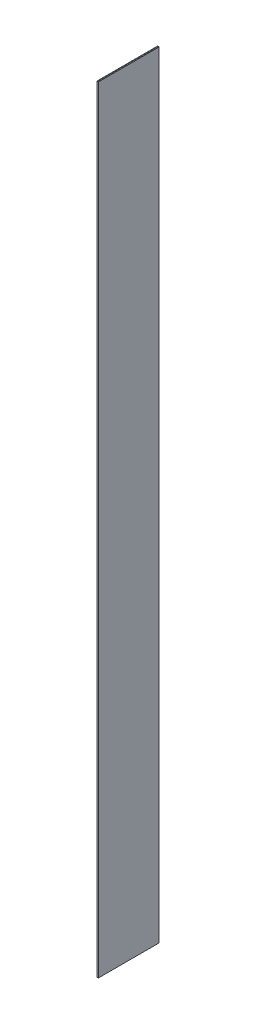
SolidWorks part; units mm, degrees
ref_plane "Front Plane" through (0, 0, 0) normal (1, 0, 0) x (0, 1, 0)
ref_plane "Top Plane" through (0, 0, 0) normal (0, 0, 1) x (0, 1, 0)
ref_plane "Right Plane" through (0, 0, 0) normal (0, 1, 0) x (-1, 0, 0)
sketch "Sketch1" plane through (0, 0, 0) normal (0, 1, 0) x (-1, 0, 0)
  line L1 (-9.525, 381) -> (9.525, 381)
  line L2 (-9.525, 381) -> (-9.525, -381)
  line L3 (-9.525, -381) -> (9.525, -381)
  line L4 (9.525, 381) -> (9.525, -381)
  line L5 (-9.525, 381) -> (9.525, -381) construction
  line L6 (-9.525, -381) -> (9.525, 381) construction
  point P0 (0, 0)
  dimension "D1" = 762
  dimension "D2" = 19.05
extrude "Boss-Extrude1" add sketch "Sketch1" along normal blind 9739.6
ref_plane "Mating plane" through (0, 0, -631) normal (0, 0, -1) x (0, 1, 0)
chamfer "Chamfer2" distance 6 angle 45 8 edges at (0, 0, 381) (9.525, 0, 0) (0, 0, -381) (-9.525, 0, 0) (0, 9739.6, -381) (9.525, 9739.6, 0) (0, 9739.6, 381) (-9.525, 9739.6, 0)
